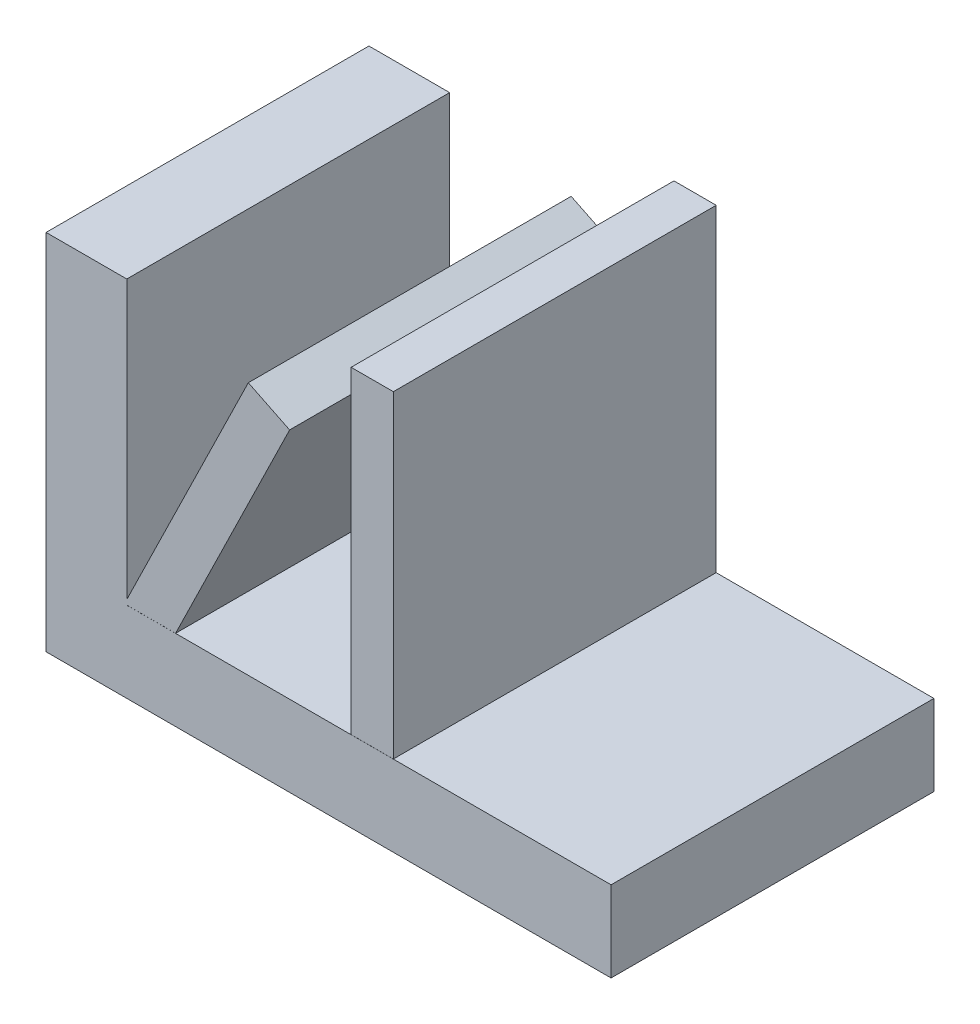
SolidWorks part; units mm, degrees
ref_plane "Front Plane" through (0, 0, 0) normal (0, 0, 1) x (1, 0, 0)
ref_plane "Top Plane" through (0, 0, 0) normal (0, 1, 0) x (1, 0, 0)
ref_plane "Right Plane" through (0, 0, 0) normal (1, 0, 0) x (0, 0, -1)
sketch "Sketch1" plane through (0, 0, 0) normal (0, 0, 1) x (1, 0, 0)
  line L0 (0, 0) -> (70, 0)
  line L1 (0, 45) -> (10, 45)
  line L2 (10, 45) -> (10, 10)
  line L3 (10, 10) -> (70, 10)
  line L4 (70, 10) -> (70, 0)
  line L5 (0, 45) -> (0, 0)
  dimension "D1" = 10
  dimension "D2" = 45
  dimension "D3" = 70
extrude "Extrude1" add sketch "Sketch1" along normal mid plane 40
sketch "Sketch2" plane through (0, 0, 0) normal (0, 0, 1) x (1, 0, 0)
  line L1 (43.0249, 10.0097) -> (37.7913, 10.0097)
  line L2 (43.0249, 10.0097) -> (43.0249, 49.4237)
  line L3 (43.0249, 49.4237) -> (37.7913, 49.4237)
  line L4 (37.7913, 10.0097) -> (37.7913, 49.4237)
  line L5 (9.704, 10.0097) -> (25.0561, 41.3988)
  line L6 (25.0561, 41.3988) -> (30.1746, 38.8954)
  line L7 (30.1746, 38.8954) -> (16.0469, 10.0097)
  line L8 (16.0469, 10.0097) -> (9.704, 10.0097)
extrude "Extrude2" add sketch "Sketch2" along normal mid plane 40
sketch "Sketch4" plane through (10, 0, 0) normal (1, 0, 0) x (0, 0, -1)
  line L0 (-20, 10) -> (20, 10) construction
  line L1 (-11.0843, 27.0843) -> (0, 16)
  line L2 (0, 16) -> (11.0843, 27.0843)
  line L3 (11.0843, 27.0843) -> (0, 38.1686)
  line L4 (0, 38.1686) -> (-11.0843, 27.0843)
  circle A0 centre (0, 27.0843) radius 7.8378 construction
  point P6 (0, 10)
  dimension "D1" = 22.1686
  dimension "D2" = 6
